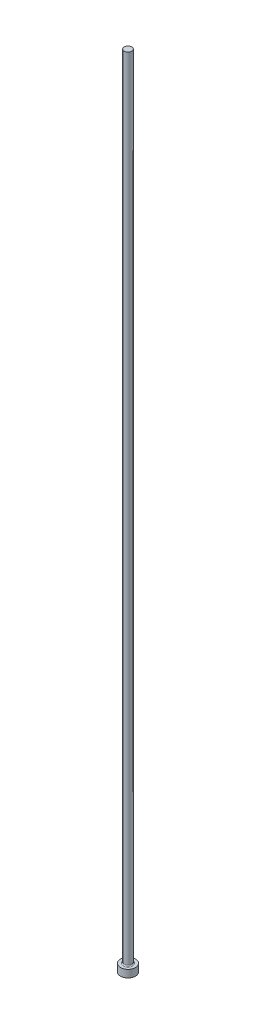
SolidWorks part; units mm, degrees
ref_plane "Plano frontal" through (0, 0, 0) normal (0, 0, 1) x (1, 0, 0)
ref_plane "Plano superior" through (0, 0, 0) normal (0, 1, 0) x (1, 0, 0)
ref_plane "Plano direito" through (0, 0, 0) normal (1, 0, 0) x (0, 0, -1)
sketch "Esboço1" plane through (0, 0, 0) normal (0, 0, 1) x (1, 0, 0)
  line L0 (0, 0) -> (1.5, 0)
  line L1 (1.5, 0) -> (1.5, 1.5)
  line L2 (1.5, 1.5) -> (0.95, 1.5)
  line L3 (0.75, 1.7) -> (0.75, 160)
  line L4 (0.75, 160) -> (0, 160)
  line L5 (0, 160) -> (0, 0) construction
  line L6 (0, 0) -> (0, 160)
  arc A0 (0.95, 1.5) -> (0.75, 1.7) centre (0.95, 1.7) cw
  dimension "D3" = 0.2
  dimension "D1" = 3
  dimension "D2" = 1.5
  dimension "D4" = 1.5
  dimension "D5" = 160
revolve "Revolução1" add sketch "Esboço1" angle 360 about L5
sketch "Esboço2"
  dimension "D1" = 0.1125
  dimension "D2" = 0.2625
  dimension "D3" = 0.1687
  dimension "D4" = 0.8063
wrap "Envolver1" sketch "Esboço2" wrap type deboss source sketch "Esboço2" thickness 0.1 parameters "D1"=0.1
